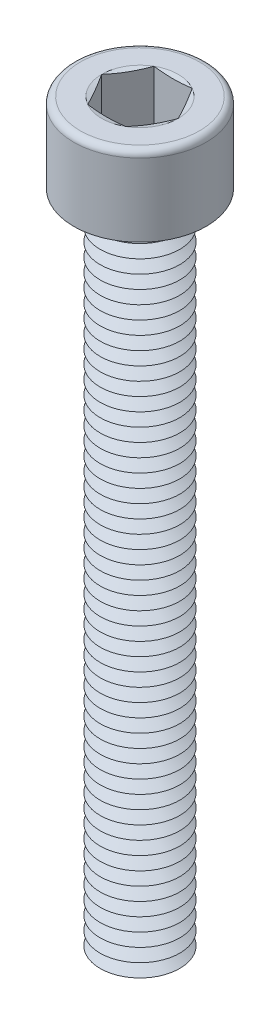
SolidWorks part; units mm, degrees
ref_plane "Front Plane" through (0, 0, 0) normal (0, 0, 1) x (1, 0, 0)
ref_plane "Top Plane" through (0, 0, 0) normal (0, 1, 0) x (1, 0, 0)
ref_plane "Right Plane" through (0, 0, 0) normal (1, 0, 0) x (0, 0, -1)
sketch "Sketch1" plane through (0, 0, 0) normal (0, 1, 0) x (1, 0, 0)
  circle A0 centre (0, 0) radius 3
  dimension "D1" = 6
extrude "Extrude1" add sketch "Sketch1" along normal blind 50
sketch "Sketch2" plane through (0, 50, 0) normal (0, 1, 0) x (1, 0, 0)
  circle A0 centre (0, 0) radius 5
  dimension "D1" = 10
extrude "Extrude2" add sketch "Sketch2" along normal blind 6
sketch "Sketch3" plane through (0, 56, 0) normal (0, 1, 0) x (1, 0, 0)
  line L1 (1.4434, 2.5) -> (-1.4434, 2.5)
  line L2 (-1.4434, 2.5) -> (-2.8868, 0)
  line L3 (-2.8868, 0) -> (-1.4434, -2.5)
  line L4 (-1.4434, -2.5) -> (1.4434, -2.5)
  line L5 (1.4434, -2.5) -> (2.8868, 0)
  line L6 (2.8868, 0) -> (1.4434, 2.5)
  circle A0 centre (0, 0) radius 2.5 construction
  dimension "D1" = 5
extrude "Extrude3" cut sketch "Sketch3" against normal blind 5
fillet "Fillet1" radius 0.5 1 edges at (0, 56, 5)
sketch "Sketch4" plane through (0, 0, 0) normal (1, 0, 0) x (0, 0, -1)
  line L0 (-2.5, 51) -> (0, 51)
  line L1 (0, 51) -> (0, 49.5566)
  line L2 (0, 49.5566) -> (-2.5, 51)
  dimension "D1" = 30
revolve "Cut-Revolve1" cut sketch "Sketch4" angle 360 about L1
sketch "Sketch5" plane through (0, 0, 0) normal (0, 0, 1) x (1, 0, 0)
  line L0 (-3, 0.5) -> (-3, -0.5)
  line L1 (-3, 50) -> (-3, 0) construction
  line L2 (-3, -0.5) -> (-2.134, 0)
  line L3 (-3, 0) -> (3, 0) construction
  line L4 (-2.134, 0) -> (-3, 0.5)
  dimension "D1" = 1
revolve "Cut-Revolve2" cut sketch "Sketch5" angle 360 about axis through (0, 50, 0) along (0, -1, 0)
pattern_linear "LPattern1" count 50 spacing 1 along (0, 1, 0) of "Cut-Revolve2"
sketch "Sketch6" plane through (0, 56, 0) normal (0, 1, 0) x (1, 0, 0)
  circle A0 centre (0, 0) radius 2.8868
extrude "Extrude4" cut sketch "Sketch6" against normal through all draft 75
